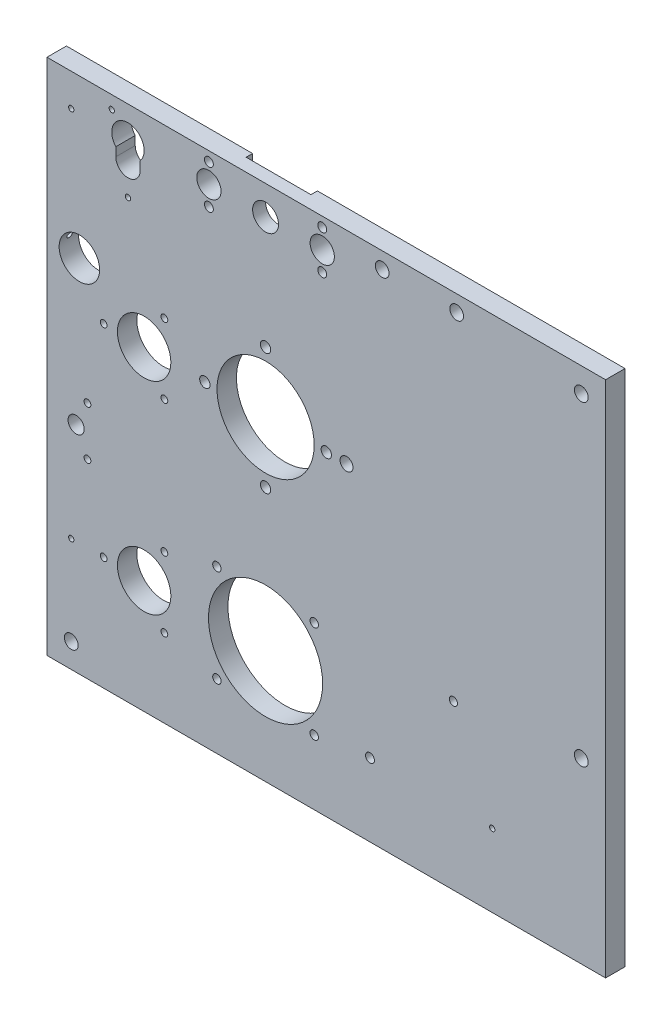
SolidWorks part; units mm, degrees
ref_plane "Plan1" through (0, 0, 0) normal (0, 0, 1) x (1, 0, 0)
ref_plane "Plan2" through (0, 0, 0) normal (0, 1, 0) x (1, 0, 0)
ref_plane "Plan3" through (0, 0, 0) normal (1, 0, 0) x (0, 0, -1)
sketch "Esquisse1" plane through (0, 0, 0) normal (0, 0, 1) x (1, 0, 0)
  line L0 (0, 0) -> (345, 0)
  line L1 (0, 0) -> (0, 320)
  line L2 (345, 320) -> (0, 320)
  line L3 (345, 320) -> (345, 0)
  circle A0 centre (135, 195) radius 30
  dimension "D3" = 60
  dimension "D4" = 125
  dimension "D5" = 210
  dimension "D1" = 345
  dimension "D2" = 320
extrude "Base-Extrusion" add sketch "Esquisse1" against normal blind 12
other "Perçage5"
sketch "Esquisse13" plane through (0, 0, 0) normal (0, 0, 1) x (1, 0, 0)
  line L0 (135, 195) -> (135, 70) construction
  circle A0 centre (135, 70) radius 35.25
  circle A2 centre (135, 195) radius 30 construction
  dimension "D1" = 70.5
  dimension "D2" = 125
other "Perçage6"
sketch "Esquisse14" plane through (0, 0, 0) normal (0, 0, 1) x (1, 0, 0)
  line L0 (0, 160) -> (345, 160) construction
  line L1 (0, 0) -> (0, 320) construction
  line L2 (345, 320) -> (345, 0) construction
  line L3 (172.5, 320) -> (172.5, 0) construction
  line L4 (345, 320) -> (0, 320) construction
  line L5 (0, 0) -> (345, 0) construction
  circle A0 centre (172.5, 195) radius 3.2
  dimension "D1" = 6.4
  dimension "D2" = 125
other "Perçage13"
sketch "Esquisse21" plane through (0, 0, 0) normal (0, 0, 1) x (1, 0, 0)
  line L0 (0, 160) -> (345, 160) construction
  line L1 (0, 0) -> (0, 320) construction
  line L2 (345, 320) -> (345, 0) construction
  line L3 (172.5, 320) -> (172.5, 0) construction
  line L4 (345, 320) -> (0, 320) construction
  line L5 (0, 0) -> (345, 0) construction
  line L6 (135, 70) -> (345, 70) construction
  line L7 (135, 70) -> (0, 70) construction
  line L8 (135, 70) -> (-61.7177, 266.7177) construction
  circle A0 centre (104.948, 100.052) radius 2.6
  dimension "D1" = 5.2
  dimension "D2" = 45
  dimension "D3" = 42.5
pattern_circular "Répétition circulaire2" count 4 every 90
pattern_circular "Répétition circulaire3" count 4 every 90
sketch "Esquisse22" plane through (0, 0, 0) normal (0, 0, 1) x (1, 0, 0)
  line L0 (60, 195) -> (135, 195) construction
  line L1 (60, 70) -> (135, 70) construction
  line L2 (60, 195) -> (60, 70) construction
  circle A0 centre (60, 195) radius 16.5
  circle A1 centre (60, 70) radius 16.5
  circle A2 centre (135, 195) radius 30 construction
  dimension "D1" = 33
  dimension "D2" = 33
  dimension "D3" = 75
extrude "Enlèv. mat.-Extru.1" cut sketch "Esquisse22" against normal through all
sketch "Esquisse23" plane through (0, 0, 0) normal (0, 0, 1) x (1, 0, 0)
  line L0 (60, 195) -> (72.5, 216.6506) construction
  line L1 (60, 195) -> (60, 239.1376) construction
  line L2 (60, 195) -> (35, 195) construction
  line L3 (60, 195) -> (72.5, 173.3494) construction
  circle A0 centre (60, 195) radius 25 construction
  circle A1 centre (72.5, 216.6506) radius 2.1
  circle A2 centre (35, 195) radius 2.1
  circle A3 centre (72.5, 173.3494) radius 2.1
  dimension "D1" = 50
  dimension "D3" = 120
  dimension "D4" = 4.2
  dimension "D2" = 30
extrude "Enlèv. mat.-Extru.2" cut sketch "Esquisse23" against normal through all
pattern_linear "Répétition linéaire1" count 2 spacing 125
sketch "Esquisse24" plane through (0, 0, 0) normal (0, 0, 1) x (1, 0, 0)
  line L0 (345, 320) -> (0, 320) construction
  line L1 (345, 320) -> (345, 0) construction
  circle A0 centre (20, 222.5) radius 12.5
  dimension "D1" = 25
  dimension "D2" = 97.5
  dimension "D3" = 325
extrude "Enlèv. mat.-Extru.3" cut sketch "Esquisse24" against normal through all
hole_wizard "Trou taraudé M4x0.71" positions "Esquisse26" profile "Esquisse25" tap size "M4x0.7" standard "ISO"
sketch "Esquisse26" plane through (0, 0, 0) normal (0, 0, 1) x (1, 0, 0)
  line L1 (345, 320) -> (0, 320) construction
  line L3 (345, 320) -> (345, 0) construction
  point P0 (40, 312)
  dimension "D1" = 8
  dimension "D2" = 305
sketch "Esquisse25" plane through (40, 312, 0) normal (1, 0, 0) x (0, -1, 0)
  line L0 (0, 0) -> (0, 12)
  line L1 (0, 12) -> (1.65, 12)
  line L2 (1.65, 12) -> (1.65, 0)
  line L5 (1.65, 0) -> (0, 0)
  line L11 (0, -6.35) -> (0, 107.95) construction
  dimension "Diamètre du trou pour taraudage jusqu'au prochain" = 3.3
  dimension "Profondeur du trou pour taraudage jusqu'au prochain" = 12
hole_wizard "Trou taraudé M4x0.72" positions "Esquisse28" profile "Esquisse27" tap size "M4x0.7" standard "ISO"
sketch "Esquisse28" plane through (0, 0, 0) normal (0, 0, 1) x (1, 0, 0)
  line L1 (345, 320) -> (345, 0) construction
  line L2 (345, 320) -> (0, 320) construction
  point P0 (50, 270)
  dimension "D1" = 295
  dimension "D2" = 50
sketch "Esquisse27" plane through (50, 270, 0) normal (1, 0, 0) x (0, -1, 0)
  line L0 (0, 0) -> (0, 13.15)
  line L1 (0, 13.15) -> (1.65, 11.5)
  line L2 (1.65, 11.5) -> (1.65, 0)
  line L5 (1.65, 0) -> (0, 0)
  line L10 (0, 13.15) -> (-1.65, 11.5) construction
  line L11 (0, -6.35) -> (0, 107.95) construction
  dimension "Diamètre du trou pour taraudage" = 3.3
  dimension "Profondeur du trou pour taraudage" = 11.5
  dimension "Angle de pointe" = 90
hole_wizard "Trou taraudé M4x0.73" positions "Esquisse30" profile "Esquisse29" tap size "M4x0.7" standard "ISO"
sketch "Esquisse30" plane through (0, 0, 0) normal (0, 0, 1) x (1, 0, 0)
  line L1 (345, 320) -> (345, 0) construction
  line L2 (345, 320) -> (0, 320) construction
  point P0 (15, 300)
  dimension "D1" = 330
  dimension "D2" = 20
sketch "Esquisse29" plane through (15, 300, 0) normal (1, 0, 0) x (0, -1, 0)
  line L0 (0, 0) -> (0, 13.15)
  line L1 (0, 13.15) -> (1.65, 11.5)
  line L2 (1.65, 11.5) -> (1.65, 0)
  line L5 (1.65, 0) -> (0, 0)
  line L10 (0, 13.15) -> (-1.65, 11.5) construction
  line L11 (0, -6.35) -> (0, 107.95) construction
  dimension "Diamètre du trou pour taraudage" = 3.3
  dimension "Profondeur du trou pour taraudage" = 11.5
  dimension "Angle de pointe" = 90
sketch "Esquisse31" plane through (0, 0, 0) normal (0, 0, 1) x (1, 0, 0)
  line L0 (345, 320) -> (0, 320) construction
  line L1 (50, 288) -> (50, 300) construction
  line L2 (57.5, 288) -> (57.5, 293.3856)
  line L3 (42.5, 288) -> (42.5, 293.3856)
  line L4 (345, 320) -> (345, 0) construction
  arc A0 (57.5, 293.3856) -> (42.5, 293.3856) centre (50, 300) ccw
  arc A1 (42.5, 288) -> (57.5, 288) centre (50, 288) ccw
  dimension "D1" = 20
  dimension "D2" = 20
  dimension "D3" = 15
  dimension "D4" = 12
  dimension "D5" = 295
extrude "Enlèv. mat.-Extru.4" cut sketch "Esquisse31" against normal through all
sketch "Esquisse32" plane through (0, 0, 0) normal (0, 0, 1) x (1, 0, 0)
  line L0 (345, 320) -> (345, 0) construction
  line L1 (345, 320) -> (0, 320) construction
  circle A0 centre (18, 132.5) radius 5
  dimension "D1" = 10
  dimension "D2" = 327
  dimension "D3" = 187.5
extrude "Enlèv. mat.-Extru.5" cut sketch "Esquisse32" against normal through all
sketch "Esquisse33" plane through (0, 0, 0) normal (0, 0, 1) x (1, 0, 0)
  line L0 (25, 147.5) -> (25, 117.5) construction
  line L1 (345, 320) -> (0, 320) construction
  line L2 (253, 310) -> (207, 310) construction
  line L3 (172.5, 195) -> (185, 195) construction
  circle A0 centre (25, 147.5) radius 2.1
  circle A1 centre (25, 117.5) radius 2.1
  circle A2 centre (18, 132.5) radius 5 construction
  circle A3 centre (15, 15) radius 4.25
  circle A4 centre (60, 195) radius 16.5 construction
  circle A5 centre (135, 70) radius 35.25 construction
  circle A6 centre (199.5, 45) radius 2.75
  circle A7 centre (330, 305) radius 4.25
  circle A8 centre (185, 195) radius 4
  circle A9 centre (253, 310) radius 4.25
  circle A10 centre (207, 310) radius 4.25
  circle A11 centre (135, 195) radius 30 construction
  circle A12 centre (135, 195) radius 30 construction
  circle A13 centre (330, 110) radius 4.25
  dimension "D1" = 4.2
  dimension "D2" = 7
  dimension "D3" = 15
  dimension "D4" = 15
  dimension "D5" = 8.5
  dimension "D6" = 180
  dimension "D7" = 120
  dimension "D8" = 5.5
  dimension "D9" = 25
  dimension "D10" = 64.5
  dimension "D11" = 8.5
  dimension "D12" = 8
  dimension "D13" = 110
  dimension "D14" = 195
  dimension "D15" = 50
  dimension "D16" = 72
  dimension "D17" = 46
  dimension "D18" = 10
  dimension "D19" = 195
  dimension "D20" = 195
extrude "Enlèv. mat.-Extru.6" cut sketch "Esquisse33" against normal through all
hole_wizard "Trou taraudé M4x0.74" positions "Esquisse35" profile "Esquisse34" tap size "M4x0.7" standard "ISO"
sketch "Esquisse35" plane through (0, 0, 0) normal (0, 0, 1) x (1, 0, 0)
  line L0 (345, 320) -> (0, 320) construction
  circle A0 centre (135, 70) radius 35.25 construction
  point P0 (15, 70)
  dimension "D1" = 250
  dimension "D2" = 120
sketch "Esquisse34" plane through (15, 70, 0) normal (1, 0, 0) x (0, -1, 0)
  line L0 (0, 0) -> (0, 13.15)
  line L1 (0, 13.15) -> (1.65, 11.5)
  line L2 (1.65, 11.5) -> (1.65, 0)
  line L5 (1.65, 0) -> (0, 0)
  line L10 (0, 13.15) -> (-1.65, 11.5) construction
  line L11 (0, -6.35) -> (0, 107.95) construction
  dimension "Diamètre du trou pour taraudage" = 3.3
  dimension "Profondeur du trou pour taraudage" = 11.5
  dimension "Angle de pointe" = 90
hole_wizard "Trou taraudé M4x0.75" positions "Esquisse37" profile "Esquisse36" tap size "M4x0.7" standard "ISO"
sketch "Esquisse37" plane through (0, 0, 0) normal (0, 0, 1) x (1, 0, 0)
  line L0 (345, 320) -> (0, 320) construction
  line L1 (345, 320) -> (345, 0) construction
  point P0 (275, 45)
  dimension "D1" = 275
  dimension "D2" = 70
sketch "Esquisse36" plane through (275, 45, 0) normal (1, 0, 0) x (0, -1, 0)
  line L0 (0, 0) -> (0, 13.15)
  line L1 (0, 13.15) -> (1.65, 11.5)
  line L2 (1.65, 11.5) -> (1.65, 0)
  line L5 (1.65, 0) -> (0, 0)
  line L10 (0, 13.15) -> (-1.65, 11.5) construction
  line L11 (0, -6.35) -> (0, 107.95) construction
  dimension "Diamètre du trou pour taraudage" = 3.3
  dimension "Profondeur du trou pour taraudage" = 11.5
  dimension "Angle de pointe" = 90
hole_wizard "Trou taraudé M6x1.01" positions "Esquisse39" profile "Esquisse38" tap size "M6x1.0" standard "ISO"
sketch "Esquisse39" plane through (0, 0, 0) normal (0, 0, 1) x (1, 0, 0)
  circle A0 centre (135, 70) radius 35.25 construction
  point P0 (251, 101)
  dimension "D1" = 116
  dimension "D2" = 31
sketch "Esquisse38" plane through (251, 101, 0) normal (1, 0, 0) x (0, -1, 0)
  line L0 (0, 0) -> (0, 19.5)
  line L1 (0, 19.5) -> (2.5, 17)
  line L2 (2.5, 17) -> (2.5, 0)
  line L5 (2.5, 0) -> (0, 0)
  line L10 (0, 19.5) -> (-2.5, 17) construction
  line L11 (0, -6.35) -> (0, 107.95) construction
  dimension "Diamètre du trou pour taraudage" = 5
  dimension "Profondeur du trou pour taraudage" = 17
  dimension "Angle de pointe" = 90
sketch "Esquisse40" plane through (0, 0, 0) normal (0, 0, 1) x (1, 0, 0)
  line L0 (100, 302) -> (135, 302) construction
  line L1 (135, 302) -> (170, 302) construction
  line L2 (100, 314) -> (170, 314) construction
  line L3 (170, 290) -> (170, 314) construction
  line L4 (100, 290) -> (100, 302) construction
  line L5 (100, 290) -> (170, 290) construction
  line L6 (345, 320) -> (345, 0) construction
  line L7 (345, 320) -> (0, 320) construction
  line L8 (100, 302) -> (100, 314) construction
  line L9 (170, 302) -> (170, 314) construction
  circle A0 centre (135, 302) radius 8
  circle A1 centre (100, 302) radius 7.5
  circle A2 centre (170, 302) radius 7.5
  circle A3 centre (100, 314) radius 2.75
  circle A4 centre (100, 290) radius 2.75
  circle A7 centre (170, 314) radius 2.75
  circle A8 centre (170, 290) radius 2.75
  dimension "D1" = 15
  dimension "D2" = 15
  dimension "D3" = 16
  dimension "D4" = 35
  dimension "D5" = 35
  dimension "D6" = 12
  dimension "D7" = 5.5
  dimension "D8" = 12
  dimension "D9" = 210
  dimension "D10" = 18
extrude "Enlèv. mat.-Extru.7" cut sketch "Esquisse40" against normal through all
sketch "Esquisse41" plane through (0, 0, -12) normal (0, 0, -1) x (-1, 0, 0)
  line L0 (-115, 302) -> (-115, 320)
  line L2 (-345, 320) -> (0, 320) construction
  line L3 (-155, 302) -> (-155, 320)
  line L4 (-155, 320) -> (-115, 320)
  arc A0 (-155, 302) -> (-115, 302) centre (-135, 302) ccw
  dimension "D1" = 40
extrude "Enlèv. mat.-Extru.8" cut sketch "Esquisse41" against normal blind 4
hole_wizard "Trou taraudé M4x0.76" positions "Esquisse43" profile "Esquisse42" tap size "M4x0.7" standard "ISO"
sketch "Esquisse43" plane through (0, 0, 0) normal (0, -1, 0) x (1, 0, 0)
  line L0 (205, -6) -> (0, -6) construction
  line L1 (0, -12) -> (0, 0) construction
  line L3 (345, -12) -> (345, 0) construction
  point P0 (205, -6)
  dimension "D1" = 140
sketch "Esquisse42" plane through (205, 0, -6) normal (1, 0, 0) x (0, 0, -1)
  line L0 (0, 0) -> (0, 17.15)
  line L1 (0, 17.15) -> (1.65, 15.5)
  line L2 (1.65, 15.5) -> (1.65, 0)
  line L5 (1.65, 0) -> (0, 0)
  line L10 (0, 17.15) -> (-1.65, 15.5) construction
  line L11 (0, -6.35) -> (0, 107.95) construction
  dimension "Diamètre du trou pour taraudage" = 3.3
  dimension "Profondeur du trou pour taraudage" = 15.5
  dimension "Angle de pointe" = 90
pattern_linear "Répétition linéaire2" count 2 spacing 145
hole_wizard "Trou taraudé M4x0.77" positions "Esquisse46" profile "Esquisse45" tap size "M4x0.7" standard "ISO"
sketch "Esquisse46" plane through (0, 0, 0) normal (-1, 0, 0) x (0, 0, 1)
  line L0 (0, 0) -> (0, 320) construction
  line L3 (-12, 320) -> (0, 320) construction
  point P0 (-6, 260)
  dimension "D1" = 6
  dimension "D2" = 60
sketch "Esquisse45" plane through (0, 260, -6) normal (0, 1, 0) x (0, 0, 1)
  line L0 (0, 0) -> (0, 17.15)
  line L1 (0, 17.15) -> (1.65, 15.5)
  line L2 (1.65, 15.5) -> (1.65, 0)
  line L5 (1.65, 0) -> (0, 0)
  line L10 (0, 17.15) -> (-1.65, 15.5) construction
  line L11 (0, -6.35) -> (0, 107.95) construction
  dimension "Diamètre du trou pour taraudage" = 3.3
  dimension "Profondeur du trou pour taraudage" = 15.5
  dimension "Angle de pointe" = 90
pattern_linear "Répétition linéaire3" count 2 spacing 34
sketch "Esquisse47" plane through (0, 0, 0) normal (0, 0, 1) x (1, 0, 0)
  line L0 (0, 0) -> (0, 320) construction
  line L1 (0, 221.0828) -> (0, 265.632)
  line L2 (0, 0) -> (345, 0) construction
  line L3 (201.0733, 0) -> (210.2408, 0)
  circle A0 centre (20, 222.5) radius 12.5 construction
  arc A1 (10.511, 230.6369) -> (7.6682, 220.4562) centre (20, 222.5) ccw
  spline_without_curve S0
  spline_without_curve S1
  spline_without_curve S2
extrude "Enlèv. mat.-Extru.9" [suppressed] cut sketch "Esquisse47" against normal blind 6
